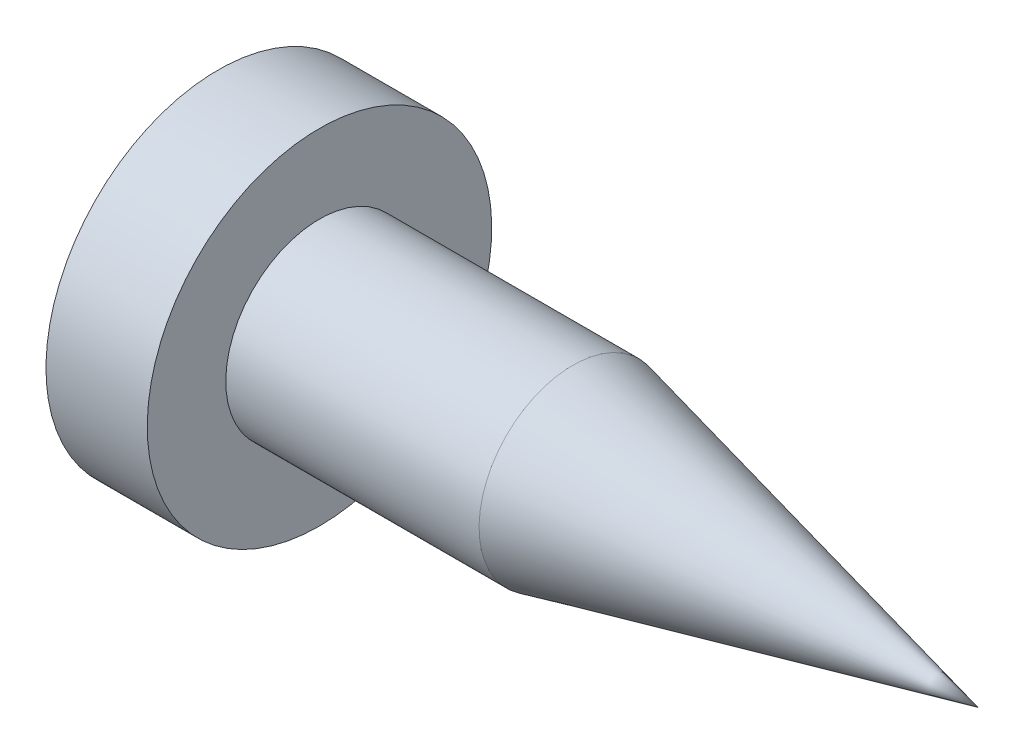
SolidWorks part; units mm, degrees
ref_plane "Plan1" through (0, 0, 0) normal (0, 0, 1) x (1, 0, 0)
ref_plane "Plan2" through (0, 0, 0) normal (0, 1, 0) x (1, 0, 0)
ref_plane "Plan3" through (0, 0, 0) normal (1, 0, 0) x (0, 0, -1)
sketch "Esquisse1" plane through (0, 0, 0) normal (0, 0, 1) x (1, 0, 0)
  line L0 (0, 1.85) -> (5, 1.85)
  line L1 (5, 1.85) -> (13, 0)
  line L2 (13, 0) -> (-3, 0)
  line L3 (-2, 0) -> (9, 0) construction
  line L4 (-2, 3.4) -> (0, 3.4)
  line L5 (0, 3.4) -> (0, 1.85)
  arc A0 (-2, 3.4) -> (-3, 0) centre (3.28, 0) ccw
  dimension "D1" = 1.85
  dimension "D2" = 13
  dimension "D3" = 5
  dimension "D4" = 2
  dimension "D5" = 3
  dimension "D6" = 3.4
revolve "Base-Révolution" add sketch "Esquisse1" angle 360 about L3
ref_plane "Plan4" through (-1, 0, 0) normal (1, 0, 0) x (0, 0, -1)
sketch "Esquisse2" plane through (-1, 0, 0) normal (1, 0, 0) x (0, 0, -1)
  line L0 (0.7, -0.5) -> (2, -0.5)
  line L1 (-2, -0.5) -> (-0.7, -0.5)
  line L2 (-2, -0.5) -> (-2, 0.5)
  line L3 (-2, 0.5) -> (-0.7, 0.5)
  line L4 (2, -0.5) -> (2, 0.5)
  line L5 (-0.5, -2) -> (0.5, -2)
  line L6 (-0.5, -2) -> (-0.5, -0.7)
  line L7 (-0.5, 2) -> (0.5, 2)
  line L8 (0.5, -2) -> (0.5, -0.7)
  line L9 (-0.5, 0.7) -> (-0.5, 2)
  line L10 (0.7, 0.5) -> (2, 0.5)
  line L11 (0.5, 0.7) -> (0.5, 2)
  arc A0 (-0.7, -0.5) -> (-0.5, -0.7) centre (-0.7, -0.7) cw
  arc A1 (-0.5, 0.7) -> (-0.7, 0.5) centre (-0.7, 0.7) cw
  arc A2 (0.7, 0.5) -> (0.5, 0.7) centre (0.7, 0.7) cw
  arc A3 (0.5, -0.7) -> (0.7, -0.5) centre (0.7, -0.7) cw
  point P19 (0.5, 0.5)
  dimension "D9" = 0.2
  dimension "D1" = 4
  dimension "D2" = 4
  dimension "D3" = 0.5
  dimension "D4" = 1
  dimension "D5" = 0.5
  dimension "D6" = 1
  dimension "D7" = 2
  dimension "D8" = 2
extrude "Enlèv. mat.-Extru.1" cut sketch "Esquisse2" against normal blind 10
